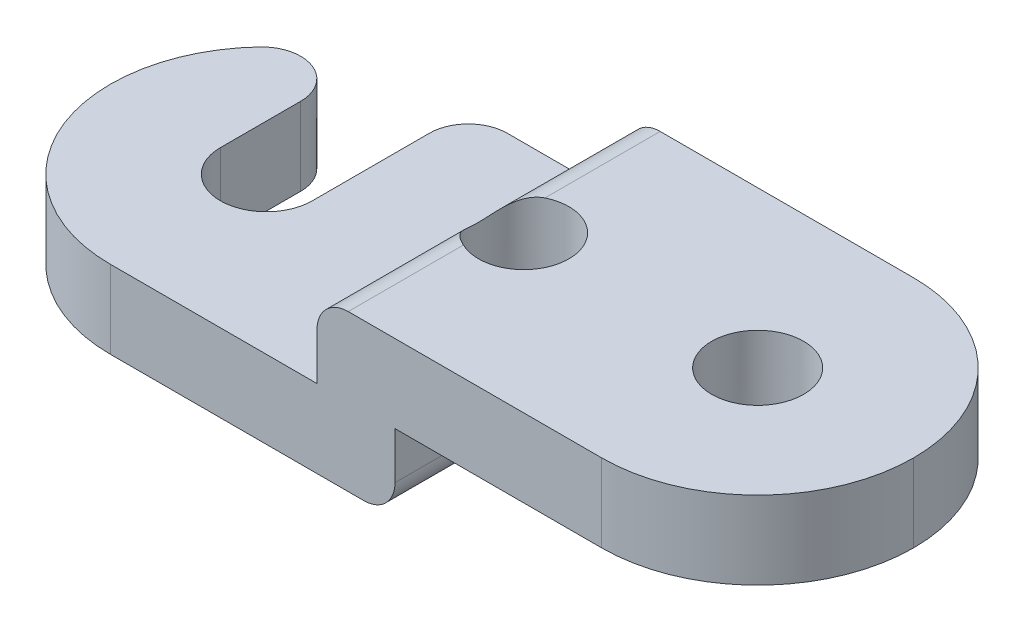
SolidWorks part; units mm, degrees
ref_plane "Front Plane" through (0, 0, 0) normal (0, 0, 1) x (1, 0, 0)
ref_plane "Top Plane" through (0, 0, 0) normal (0, 1, 0) x (1, 0, 0)
ref_plane "Right Plane" through (0, 0, 0) normal (1, 0, 0) x (0, 0, -1)
sketch "Sketch1" plane through (0, 0, 0) normal (0, 1, 0) x (1, 0, 0)
  line L1 (5.15, -2) -> (-5.15, -2)
  line L2 (5.15, -2) -> (5.15, 2)
  line L3 (5.15, 2) -> (-5.15, 2)
  line L4 (-5.15, -2) -> (-5.15, 2)
  line L5 (5.15, -2) -> (-5.15, 2) construction
  line L6 (5.15, 2) -> (-5.15, -2) construction
  point P0 (0, 0)
  dimension "D1" = 4
  dimension "D2" = 10.3
extrude "Boss-Extrude1" add sketch "Sketch1" along normal blind 2
fillet "Fillet1" radius 2 2 edges at (5.15, 1, -2) (5.15, 1, 2)
fillet "Fillet2" radius 2 2 edges at (-5.15, 1, -2) (-5.15, 1, 2)
sketch "Sketch2" plane through (0, 2, 0) normal (0, 1, 0) x (1, 0, 0)
  line L1 (3.15, 2) -> (-3.15, 2) construction
  line L3 (-0.5, -2) -> (-3.15, -2)
  line L4 (-3.15, 2) -> (-0.5, 2)
  line L5 (-0.5, 2) -> (-0.5, -2)
  arc A0 (-3.15, -2) -> (-3.15, 2) centre (-3.15, 0) cw
extrude "Cut-Extrude1" cut sketch "Sketch2" against normal blind 1
sketch "Sketch3" plane through (0, 0, 0) normal (0, -1, 0) x (1, 0, 0)
  line L0 (0.5, 2) -> (0.5, -2)
  line L1 (-3.15, 2) -> (3.15, 2) construction
  line L2 (3.15, -2) -> (-3.15, -2) construction
  line L3 (0.5, -2) -> (3.15, -2)
  line L4 (3.15, 2) -> (0.5, 2)
  line L5 (-0.5, 2) -> (-0.5, -2) construction
  arc A0 (3.15, -2) -> (3.15, 2) centre (3.15, 0) ccw
  dimension "D1" = 1
extrude "Cut-Extrude2" cut sketch "Sketch3" against normal blind 1
fillet "Fillet3" radius 0.4 2 edges at (-0.5, 2, 0) (0.5, 0, 0)
sketch "Sketch4" plane through (0, 2, 0) normal (0, 1, 0) x (1, 0, 0)
  circle A0 centre (3.15, 0) radius 0.59
  dimension "D1" = 1.18
extrude "Cut-Extrude3" cut sketch "Sketch4" against normal blind 10
sketch "Sketch5" plane through (0, 2, 0) normal (0, 1, 0) x (1, 0, 0)
  circle A0 centre (0.15, 0) radius 0.58
  circle A1 centre (3.15, 0) radius 0.59 construction
  dimension "D1" = 1.16
  dimension "D2" = 3
extrude "Cut-Extrude5" cut sketch "Sketch5" against normal blind 1
sketch "Sketch6" plane through (0, 1, 0) normal (0, 1, 0) x (1, 0, 0)
  circle A0 centre (-3.15, 0) radius 0.59
  dimension "D1" = 1.18
extrude "Cut-Extrude6" cut sketch "Sketch6" against normal blind 1
sketch "Sketch7" plane through (0, 1, 0) normal (0, 1, 0) x (-1, 0, 0)
  line L0 (3.74, 0) -> (3.74, -1.911)
  line L1 (2.56, 0) -> (2.56, -2)
  line L2 (0.5, -2) -> (3.15, -2) construction
  line L3 (2.56, -2) -> (3.15, -2)
  circle A0 centre (3.15, 0) radius 0.59 construction
  arc A1 (3.15, -2) -> (5.15, 0) centre (3.15, 0) ccw construction
  arc A2 (3.15, -2) -> (3.74, -1.911) centre (3.15, 0) ccw
extrude "Cut-Extrude7" cut sketch "Sketch7" against normal through all and the other way through all
fillet "Fillet4" radius 0.5 2 edges at (-3.74, 0.5, -1.911) (-2.56, 0.5, -2)
